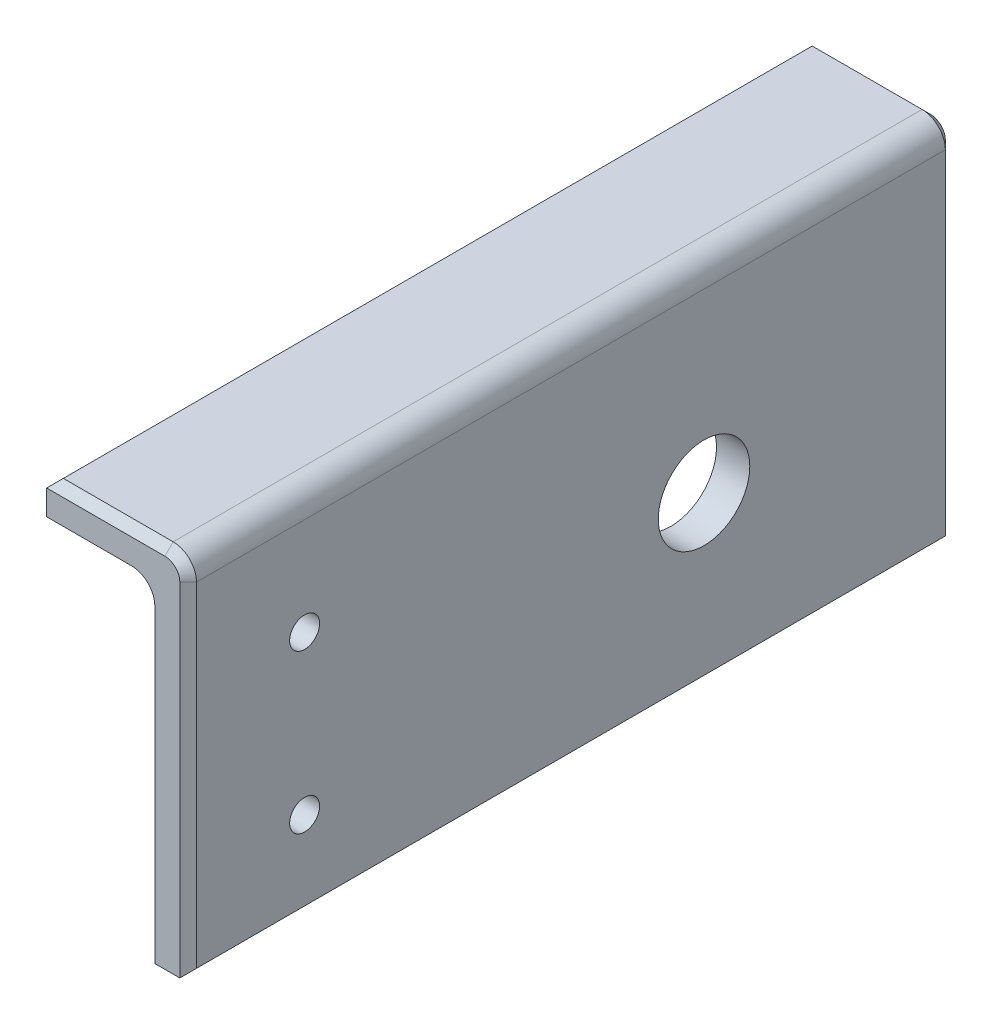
SolidWorks part; units mm, degrees
ref_plane "Front Plane" through (0, 0, 0) normal (0, 0, 1) x (1, 0, 0)
ref_plane "Top Plane" through (0, 0, 0) normal (0, 1, 0) x (1, 0, 0)
ref_plane "Right Plane" through (0, 0, 0) normal (1, 0, 0) x (0, 0, -1)
sketch "Sketch1" plane through (0, 0, 0) normal (1, 0, 0) x (0, 0, -1)
  line L1 (0, 20) -> (-46, 20)
  line L2 (0, 20) -> (0, 0)
  line L3 (0, 0) -> (-46, 0)
  line L4 (-46, 20) -> (-46, 0)
  point P4 (14.5167, 7.3331)
  point P5 (0, 0)
  point P7 (0, 7.1572)
  point P8 (11.3741, 6.6369)
  point P9 (0, 0)
  dimension "D1" = 20
  dimension "D2" = 46
extrude "Boss-Extrude1" add sketch "Sketch1" along normal blind 2
sketch "Sketch2" plane through (2, 0, 0) normal (1, 0, 0) x (0, 0, -1)
  line L0 (-39, 20) -> (-39, 0) construction
  line L1 (0, 20) -> (-46, 20) construction
  line L2 (-46, 0) -> (0, 0) construction
  line L4 (-46, 10) -> (0, 10) construction
  line L5 (-46, 20) -> (-46, 0) construction
  line L6 (0, 0) -> (0, 20) construction
  circle A0 centre (-39, 14.75) radius 0.9
  circle A1 centre (-39, 5.25) radius 0.9
  circle A2 centre (-15, 10) radius 2.75
  dimension "D1" = 1.8
  dimension "D2" = 7
  dimension "D3" = 9.5
  dimension "D4" = 5.5
  dimension "D5" = 15
extrude "Cut-Extrude1" cut sketch "Sketch2" against normal blind 10
sketch "Sketch3" plane through (0, 20, 0) normal (0, 1, 0) x (1, 0, 0)
  line L1 (2, 0) -> (-6.5, 0)
  line L2 (2, 0) -> (2, -46)
  line L3 (2, -46) -> (-6.5, -46)
  line L4 (-6.5, 0) -> (-6.5, -46)
  point P7 (2, -46)
  dimension "D1" = 8.5
extrude "Boss-Extrude2" add sketch "Sketch3" along normal blind 2
fillet "Fillet1" radius 1.4 1 edges at (0, 20, 23)
fillet "Fillet2" radius 1.4 1 edges at (2, 22, 23)
chamfer "Chamfer1" distance 0.5 angle 45 8 edges at (2, 10.3, 0) (2, 10.3, 46) (1.5899, 21.5899, 0) (1.5899, 21.5899, 46) (-2.95, 22, 0) (-6.5, 22, 23) (-2.95, 22, 46) (2, 0, 23)
